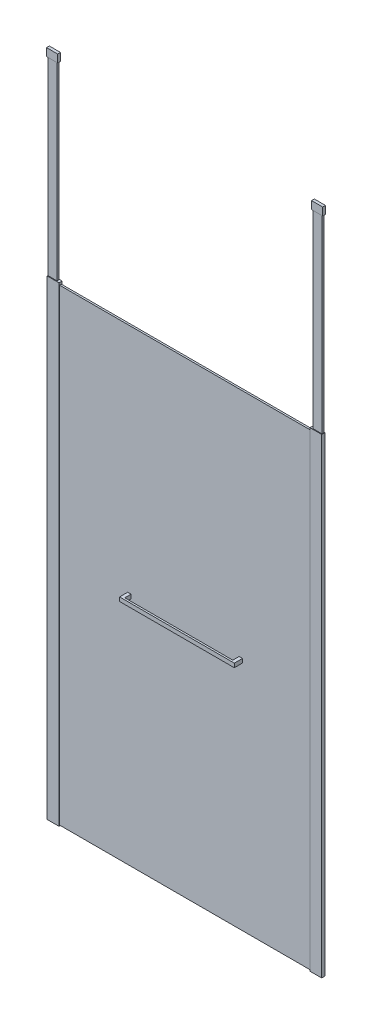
SolidWorks part; units mm, degrees
ref_plane "Płaszczyzna przednia" through (0, 0, 0) normal (0, 0, 1) x (1, 0, 0)
ref_plane "Płaszczyzna górna" through (0, 0, 0) normal (0, 1, 0) x (1, 0, 0)
ref_plane "Płaszczyzna prawa" through (0, 0, 0) normal (1, 0, 0) x (0, 0, -1)
sketch "Szkic1" plane through (0, 0, 0) normal (0, 1, 0) x (1, 0, 0)
  line L0 (0, 0) -> (0, 14)
  line L1 (0, 14) -> (53, 14)
  line L2 (53, 14) -> (53, 11)
  line L3 (53, 11) -> (42.9, 11)
  line L4 (42.9, 11) -> (42.9, 3)
  line L5 (42.9, 3) -> (53, 3)
  line L6 (53, 3) -> (53, 0)
  line L7 (53, 0) -> (0, 0)
  dimension "D1" = 53
  dimension "D2" = 14
  dimension "D3" = 10.1
  dimension "D4" = 3
  dimension "D5" = 8
extrude "Dodanie-wyciągnięcie1" add sketch "Szkic1" along normal blind 2100 from offset 3
sketch "Szkic2" plane through (0, 3, 0) normal (0, -1, 0) x (1, 0, 0)
  line L0 (42.9, -11) -> (53, -11) construction
  line L1 (42.9, -3) -> (1189.9, -3)
  line L2 (42.9, -3) -> (42.9, -11)
  line L3 (42.9, -11) -> (1189.9, -11)
  line L4 (1189.9, -3) -> (1189.9, -11)
  dimension "D1" = 1147
extrude "Dodanie-wyciągnięcie2" add sketch "Szkic2" against normal blind 2100 separate body
sketch "Szkic3" plane through (0, 3, 0) normal (0, -1, 0) x (1, 0, 0)
  line L0 (1179.8, -3) -> (1179.8, 0)
  line L1 (1189.9, -3) -> (42.9, -3) construction
  line L2 (1179.8, 0) -> (1232.8, 0)
  line L3 (1232.8, 0) -> (1232.8, -14)
  line L4 (1232.8, -14) -> (1179.8, -14)
  line L5 (1179.8, -14) -> (1179.8, -11)
  line L6 (1179.8, -11) -> (1189.9, -11)
  line L7 (1189.9, -11) -> (1189.9, -3)
  line L8 (1189.9, -3) -> (1179.8, -3)
  line L9 (42.9, -11) -> (1189.9, -11) construction
  line L10 (1189.9, -11) -> (1189.9, -3) construction
  dimension "D1" = 10.1
  dimension "D2" = 3
  dimension "D3" = 3
  dimension "D4" = 53
extrude "Dodanie-wyciągnięcie3" add sketch "Szkic3" against normal blind 2108 separate body
sketch "Szkic4" plane through (0, 2103, 0) normal (0, 1, 0) x (1, 0, 0)
  line L1 (0, 14) -> (53, 14)
  line L2 (0, 14) -> (0, 0)
  line L3 (0, 0) -> (53, 0)
  line L4 (53, 14) -> (53, 0)
extrude "Dodanie-wyciągnięcie4" add sketch "Szkic4" along normal blind 11
sketch "Szkic5" plane through (0, 2111, 0) normal (0, 1, 0) x (1, 0, 0)
  line L1 (1232.8, 14) -> (1179.8, 14)
  line L2 (1232.8, 14) -> (1232.8, 0)
  line L3 (1232.8, 0) -> (1179.8, 0)
  line L4 (1179.8, 14) -> (1179.8, 0)
extrude "Dodanie-wyciągnięcie5" add sketch "Szkic5" along normal blind 3
sketch "Szkic6" plane through (1179.8, 0, 0) normal (-1, 0, 0) x (0, 0, 1)
  line L0 (-11, 2111) -> (-3, 2111) construction
  line L1 (-2.95, 2111) -> (-11.05, 2111)
  line L2 (-2.95, 2111) -> (-2.95, 2103.2)
  line L3 (-2.95, 2103.2) -> (-11.05, 2103.2)
  line L4 (-11.05, 2111) -> (-11.05, 2103.2)
  point P6 (-7, 2111)
  dimension "D1" = 8.1
  dimension "D2" = 7.8
extrude "Dodanie-wyciągnięcie6" add sketch "Szkic6" against normal blind 15
sketch "Szkic7" plane through (0, 3, 0) normal (0, -1, 0) x (1, 0, 0)
  line L1 (1179.8, 0) -> (1232.8, 0)
  line L2 (1179.8, 0) -> (1179.8, -14)
  line L3 (1179.8, -14) -> (1232.8, -14)
  line L4 (1232.8, 0) -> (1232.8, -14)
extrude "Dodanie-wyciągnięcie7" add sketch "Szkic7" along normal blind 3
sketch "Szkic8" plane through (0, 3, 0) normal (0, -1, 0) x (1, 0, 0)
  line L1 (0, 0) -> (53, 0)
  line L2 (0, 0) -> (0, -14)
  line L3 (0, -14) -> (53, -14)
  line L4 (53, 0) -> (53, -14)
extrude "Dodanie-wyciągnięcie8" add sketch "Szkic8" along normal blind 3
sketch "Szkic9" plane through (0, 2114, 2099.6) normal (0, -1, 0) x (-1, 0, 0)
  line L0 (0, 2113.6) -> (0, 2099.6) construction
  line L1 (-1231.3, 2110.6) -> (-1191.3, 2110.6)
  line L2 (-1231.3, 2110.6) -> (-1231.3, 2102.6)
  line L3 (-1231.3, 2102.6) -> (-1191.3, 2102.6)
  line L4 (-1191.3, 2110.6) -> (-1191.3, 2102.6)
  line L5 (-1.5, 2102.6) -> (-41.5, 2102.6)
  line L6 (-1.5, 2102.6) -> (-1.5, 2110.6)
  line L7 (-1179.8, 2113.6) -> (-1232.8, 2113.6) construction
  line L8 (-1232.8, 2113.6) -> (-1232.8, 2099.6) construction
  line L9 (-1.5, 2110.6) -> (-41.5, 2110.6)
  line L10 (-41.5, 2102.6) -> (-41.5, 2110.6)
  line L11 (-53, 2113.6) -> (0, 2113.6) construction
  dimension "D1" = 3
  dimension "D2" = 1.5
  dimension "D3" = 8
  dimension "D4" = 40
  dimension "D5" = 1.5
  dimension "D6" = 40
  dimension "D7" = 3
  dimension "D8" = 8
extrude "Dodanie-wyciągnięcie9" add sketch "Szkic9" against normal blind 883 separate body
sketch "Szkic10" plane through (0, 2997, 0) normal (0, 1, 0) x (-1, 0, 0)
  line L0 (-1191.3, -3) -> (-1191.3, -11) construction
  line L1 (-1236.3, -0.75) -> (-1186.3, -0.75)
  line L2 (-1236.3, -0.75) -> (-1236.3, -13.25)
  line L3 (-1236.3, -13.25) -> (-1186.3, -13.25)
  line L4 (-1186.3, -0.75) -> (-1186.3, -13.25)
  line L5 (-1236.3, -0.75) -> (-1186.3, -13.25) construction
  line L6 (-1236.3, -13.25) -> (-1186.3, -0.75) construction
  line L8 (-1211.3, -7) -> (-1231.3, -7) construction
  line L9 (-1231.3, -11) -> (-1231.3, -3) construction
  line L10 (-21.5, -11) -> (-21.5, -7) construction
  line L11 (3.5, -13.25) -> (-46.5, -13.25)
  line L12 (3.5, -13.25) -> (3.5, -0.75)
  line L13 (3.5, -0.75) -> (-46.5, -0.75)
  line L14 (-46.5, -13.25) -> (-46.5, -0.75)
  line L15 (3.5, -13.25) -> (-46.5, -0.75) construction
  line L16 (3.5, -0.75) -> (-46.5, -13.25) construction
  line L17 (-1.5, -11) -> (-41.5, -11) construction
  line L18 (-21.5, -7) -> (-1.5, -7) construction
  line L19 (-1.5, -3) -> (-1.5, -11) construction
  point P0 (-1211.3, -7)
  point P9 (-21.5, -7)
  dimension "D1" = 12.5
  dimension "D2" = 50
  dimension "D3" = 50
  dimension "D4" = 12.5
  dimension "D5" = 5
extrude "Dodanie-wyciągnięcie10" add sketch "Szkic10" along normal blind 35 from offset 32
ref_plane "Płaszczyzna1" through (1211.3, 0, 0) normal (1, 0, 0) x (0, 0, -1)
sketch "Szkic12" plane through (0, 0, -3) normal (0, 0, 1) x (1, 0, 0)
  line L0 (616.4, 1409.7928) -> (616.4, 762.3594) construction
  line L1 (366.4, 1053) -> (866.4, 1053) construction
  line L2 (42.9, 2103) -> (42.9, 3) construction
  line L3 (1189.9, 2103) -> (1189.9, 3) construction
  line L5 (358.9, 1062) -> (373.9, 1062)
  line L6 (358.9, 1062) -> (358.9, 1044)
  line L7 (358.9, 1044) -> (373.9, 1044)
  line L8 (373.9, 1062) -> (373.9, 1044)
  line L9 (358.9, 1062) -> (373.9, 1044) construction
  line L10 (358.9, 1044) -> (373.9, 1062) construction
  line L11 (858.9, 1062) -> (873.9, 1062)
  line L12 (858.9, 1062) -> (858.9, 1044)
  line L13 (858.9, 1044) -> (873.9, 1044)
  line L14 (873.9, 1062) -> (873.9, 1044)
  line L15 (858.9, 1062) -> (873.9, 1044) construction
  line L16 (858.9, 1044) -> (873.9, 1062) construction
  dimension "D1" = 1053
  dimension "D2" = 500
  dimension "D3" = 15
  dimension "D4" = 18
extrude "Dodanie-wyciągnięcie11" add sketch "Szkic12" along normal blind 36.5 and the other way blind 18 separate body
sketch "Szkic13" plane through (373.9, 0, 0) normal (1, 0, 0) x (0, 0, -1)
  line L0 (21, 1044) -> (-33.5, 1044) construction
  line L1 (-33.5, 1062) -> (-25.5, 1062)
  line L2 (-33.5, 1062) -> (-33.5, 1044)
  line L3 (-33.5, 1044) -> (-25.5, 1044)
  line L4 (-25.5, 1062) -> (-25.5, 1044)
  dimension "D1" = 8
extrude "Dodanie-wyciągnięcie12" add sketch "Szkic13" along normal up to surface (485 mm away)
